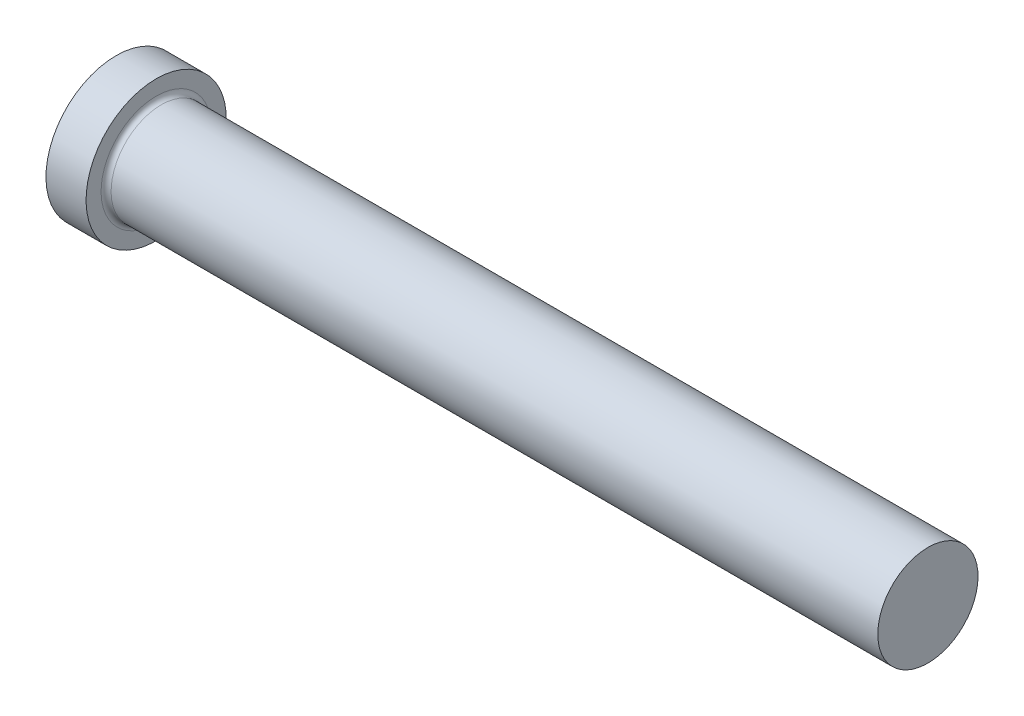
SolidWorks part; units mm, degrees
ref_plane "Plane1" through (0, 0, 0) normal (0, 0, 1) x (1, 0, 0)
ref_plane "Plane2" through (0, 0, 0) normal (0, 1, 0) x (1, 0, 0)
ref_plane "Plane3" through (0, 0, 0) normal (1, 0, 0) x (0, 0, -1)
sketch "Sketch1" plane through (0, 0, 0) normal (0, 0, 1) x (1, 0, 0)
  line L0 (-6.35, 0) -> (-6.35, 11.1125)
  line L1 (-6.35, 11.1125) -> (0, 11.1125)
  line L2 (0, 11.1125) -> (0, 8.7312)
  line L3 (0.7937, 7.9375) -> (122.2375, 7.9375)
  line L4 (122.2375, 7.9375) -> (122.2375, 0)
  line L5 (122.2375, 0) -> (-6.35, 0)
  line L6 (122.2375, 0) -> (-6.35, 0) construction
  arc A0 (0, 8.7312) -> (0.7937, 7.9375) centre (0.7937, 8.7312) ccw
revolve "Base-Revolve" add sketch "Sketch1" angle 360 about L6
equation "\"D2@Sketch1\" = \"HeadHeight@Sketch1\""
